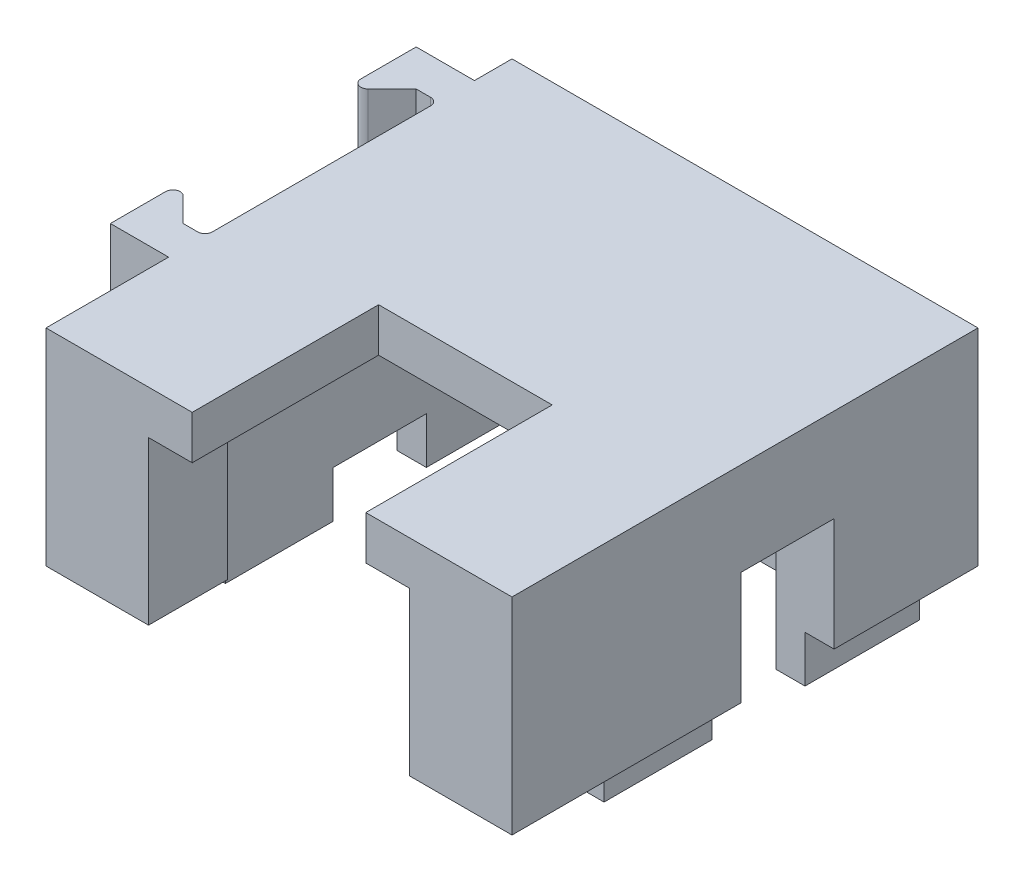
SolidWorks part; units mm, degrees
ref_plane "Front Plane" through (0, 0, 0) normal (0, 0, 1) x (1, 0, 0)
ref_plane "Top Plane" through (0, 0, 0) normal (0, 1, 0) x (1, 0, 0)
ref_plane "Right Plane" through (0, 0, 0) normal (1, 0, 0) x (0, 0, -1)
sketch "Sketch1" plane through (0, 0, 0) normal (0, 1, 0) x (1, 0, 0)
  line L1 (-12.7, 12.7) -> (12.7, 12.7)
  line L2 (-12.7, 12.7) -> (-12.7, -12.7)
  line L3 (-12.7, -12.7) -> (12.7, -12.7)
  line L4 (12.7, 12.7) -> (12.7, -12.7)
  line L5 (-12.7, 12.7) -> (12.7, -12.7) construction
  line L6 (-12.7, -12.7) -> (12.7, 12.7) construction
  point P0 (0, 0)
  dimension "D1" = 25.4
  dimension "D2" = 25.4
extrude "Boss-Extrude1" add sketch "Sketch1" along normal blind 11.2395
sketch "Sketch2" plane through (0, 0, 0) normal (0, -1, 0) x (-1, 0, 0)
  line L0 (12.7, -12.7) -> (-12.7, -12.7) construction
  line L1 (9.525, 9.525) -> (-9.525, 9.525)
  line L2 (9.525, 9.525) -> (9.525, -9.525)
  line L3 (9.525, -9.525) -> (-9.525, -9.525)
  line L4 (-9.525, 9.525) -> (-9.525, -9.525)
  line L5 (9.525, 9.525) -> (-9.525, -9.525) construction
  line L6 (9.525, -9.525) -> (-9.525, 9.525) construction
  line L7 (12.7, 12.7) -> (12.7, -12.7) construction
  point P0 (0, 0)
  dimension "D1" = 3.175
  dimension "D2" = 3.175
extrude "Cut-Extrude1" cut sketch "Sketch2" against normal offset from surface (8.8582 mm away) 2.3813
ref_plane "Plane1" through (0, 0, 0) normal (-1, 0, 0) x (0, 0, 1)
sketch "Sketch5" plane through (0, 11.2395, 0) normal (0, 1, 0) x (1, 0, 0)
  line L0 (-7.112, -12.7) -> (-7.112, -2.54)
  line L1 (-12.7, -12.7) -> (12.7, -12.7) construction
  line L2 (-7.112, -2.54) -> (7.112, -2.54)
  line L3 (7.112, -2.54) -> (7.112, -12.7)
  line L4 (7.112, -12.7) -> (-7.112, -12.7)
  line L6 (0, 12.7) -> (0, -12.7) construction
  line L7 (12.7, 12.7) -> (-12.7, 12.7) construction
  dimension "D1" = 10.16
  dimension "D2" = 14.224
extrude "Cut-Extrude3" cut sketch "Sketch5" against normal through all
sketch "Sketch16" plane through (0, 0, 0) normal (0, -1, 0) x (1, 0, 0)
  line L0 (-9.525, 9.525) -> (-12.7, 9.525) construction
  line L2 (-11.1125, 9.525) -> (-9.525, 9.525)
  line L3 (-9.525, -9.525) -> (-12.7, -9.525) construction
  line L5 (-12.7, -12.7) -> (-12.7, 12.7) construction
  line L6 (-11.1125, 9.525) -> (-11.1125, -9.525)
  line L7 (9.525, -9.525) -> (9.525, -12.7) construction
  line L8 (12.7, -12.7) -> (-12.7, -12.7) construction
  line L9 (9.525, -11.1125) -> (-11.1125, -11.1125)
  line L10 (-11.1125, -11.1125) -> (-11.1125, -9.525)
  line L11 (9.525, 9.525) -> (12.7, 9.525) construction
  line L12 (12.7, 12.7) -> (12.7, -12.7) construction
  line L13 (11.1125, 9.525) -> (11.1125, -11.1125)
  line L14 (9.525, -11.1125) -> (11.1125, -11.1125)
  line L15 (-11.1125, 6.096) -> (-9.525, 6.096)
  line L17 (11.1125, 9.525) -> (9.525, 9.525)
  line L18 (9.525, 6.096) -> (11.1125, 6.096)
  line L21 (9.525, 9.525) -> (9.525, -9.525)
  line L22 (9.525, -9.525) -> (-9.525, -9.525)
  line L23 (-9.525, -9.525) -> (-9.525, 9.525)
  dimension "D1" = 3.429
extrude "Boss-Extrude2" add sketch "Sketch16" along normal blind 2.54 contours L18 L15 L6 L10 L9 L14 L13 M10 M11 M12
sketch "Sketch14" plane through (12.7, -0.7937, 0) normal (-1, 0, 0) x (0, 1, 0)
  line L0 (12.0332, -12.7) -> (12.0332, 12.7) construction
  line L1 (4.572, -0.2223) -> (6.9532, -0.2223)
  line L2 (4.572, -0.2223) -> (4.572, 4.8578)
  line L3 (4.572, 4.8578) -> (6.9532, 4.8578)
  line L4 (6.9532, -0.2223) -> (6.9532, 4.8578)
  line L5 (12.0332, 4.8578) -> (0.7937, 4.8578) construction
  line L6 (12.0332, -12.7) -> (0.7937, -12.7) construction
  line L7 (12.0332, -0.2223) -> (0.7937, -0.2223) construction
  line L8 (0.7937, -12.7) -> (0.7937, 12.7) construction
  dimension "D1" = 5.08
  dimension "D2" = 2.3813
  dimension "D3" = 12.4777
  dimension "D4" = 5.08
sketch "Sketch15" plane through (0, -2.54, 0) normal (0, -1, 0) x (1, 0, 0)
  line L1 (12.7, -4.8578) -> (-0.6961, -4.8578)
  line L2 (12.7, -4.8578) -> (12.7, 0.2222)
  line L3 (12.7, 0.2222) -> (-0.6961, 0.2222)
  line L4 (-0.6961, -4.8578) -> (-0.6961, 0.2222)
  line L6 (12.7, 0.2222) -> (12.7, -4.8578) construction
  line L7 (12.7, 12.7) -> (12.7, -12.7) construction
  dimension "D1" = 13.3961
loft "Cut-Loft4" cut profiles "Sketch14", "Sketch15"
sketch "Sketch20" plane through (0, 0, 2.54) normal (0, 0, 1) x (1, 0, 0)
  line L0 (7.112, 8.8582) -> (-7.112, 8.8582) construction
  line L1 (-7.112, 11.2395) -> (-4.7307, 11.2395)
  line L2 (-7.112, 11.2395) -> (-7.112, 8.8582)
  line L3 (-7.112, 8.8582) -> (-4.7307, 8.8582)
  line L4 (-4.7307, 11.2395) -> (-4.7307, 8.8582)
  line L6 (7.112, 11.2395) -> (4.7308, 11.2395)
  line L7 (7.112, 11.2395) -> (7.112, 8.8582)
  line L8 (7.112, 8.8582) -> (4.7308, 8.8582)
  line L9 (4.7308, 11.2395) -> (4.7308, 8.8582)
  dimension "D1" = 2.3813
  dimension "D2" = 2.3813
extrude "Boss-Extrude3" add sketch "Sketch20" along normal up to surface (10.16 mm away)
sketch "Sketch21" plane through (0, 0, 9.525) normal (0, 0, -1) x (-1, 0, 0)
  line L1 (7.112, 8.8582) -> (9.525, 8.8582)
  line L2 (7.112, 8.8582) -> (7.112, 0)
  line L3 (7.112, 0) -> (9.525, 0)
  line L4 (9.525, 8.8582) -> (9.525, 0)
  line L5 (-9.525, 0) -> (-7.112, 0)
  line L6 (-9.525, 0) -> (-9.525, 8.8582)
  line L7 (-9.525, 8.8582) -> (-7.112, 8.8582)
  line L8 (-7.112, 0) -> (-7.112, 8.8582)
extrude "Boss-Extrude4" add sketch "Sketch21" along normal blind 1.143
sketch "Sketch22" plane through (-12.7, 0, 0) normal (-1, 0, 0) x (0, 0, 1)
  line L0 (-12.7, 0) -> (12.7, 0) construction
  line L1 (-4.8578, 0) -> (0.2222, 0)
  line L2 (-4.8578, 0) -> (-4.8578, -2.54)
  line L3 (-4.8578, -2.54) -> (0.2222, -2.54)
  line L4 (0.2222, 0) -> (0.2222, -2.54)
  line L5 (-4.8578, 4.0976) -> (-4.8578, -2.54) construction
  line L6 (0.2222, -2.54) -> (0.2222, 4.0976) construction
  line L7 (6.096, -2.54) -> (-11.1125, -2.54) construction
extrude "Cut-Extrude4" cut sketch "Sketch22" against normal up to surface (3.175 mm away)
sketch "Sketch23" plane through (0, 0, 0) normal (0, -1, 0) x (1, 0, 0)
  line L0 (-12.7, -10.6521) -> (-15.875, -10.6521)
  line L1 (-12.7, -12.7) -> (-12.7, 12.7) construction
  line L2 (-15.875, -10.6521) -> (-15.875, -6.6834)
  line L3 (-15.875, -6.6834) -> (-13.8906, -8.6677)
  line L4 (-13.8906, -8.6677) -> (-12.7, -8.6677)
  line L5 (-12.7, -8.6677) -> (-12.7, -10.6521)
  dimension "D1" = 45
  dimension "D2" = 1.1906
  dimension "D3" = 3.175
  dimension "D4" = 3.9688
  dimension "D5" = 3.81
extrude "Boss-Extrude5" add sketch "Sketch23" against normal up to surface (11.2395 mm away)
fillet "Fillet1" radius 0.3969 2 edges at (-15.875, 5.6197, -6.6834)
ref_plane "Plane2" through (0, 0, -2.3178) normal (0, 0, 1) x (1, 0, 0)
mirror "Mirror1" about plane through (0, 0, -2.3178) normal (0, 0, 1) of "Fillet1", "Boss-Extrude5"
sketch "Sketch24" plane through (0, 0, 0) normal (0, -1, 0) x (1, 0, 0)
  line L1 (-12.7, -10.6521) -> (-15.875, -10.6521)
  line L2 (-12.7, -10.6521) -> (-12.7, 6.0166)
  line L3 (-12.7, 6.0166) -> (-15.875, 6.0166)
  line L4 (-15.875, -10.6521) -> (-15.875, 6.0166)
extrude "Cut-Extrude5" cut sketch "Sketch24" against normal blind 0.254
sketch "Sketch25" plane through (0, 0, -10.6521) normal (0, 0, -1) x (-1, 0, 0)
  line L0 (14.2875, 11.2395) -> (14.2875, 0.254) construction
  line L1 (15.875, 11.2395) -> (12.7, 11.2395) construction
  line L2 (15.875, 0.254) -> (12.7, 0.254) construction
  point P6 (14.2875, 5.7468)
hole_wizard "#0-80 Tapped Hole1" positions "3DSketch1" profile "Sketch26" tap size "#0-80" standard "ANSI Inch"
sketch3d "3DSketch1"
  point P0 (-14.2875, 5.7468, -10.6521)
sketch "Sketch26" plane through (-14.2875, 5.7468, -10.6521) normal (1, 0, 0) x (0, 1, 0)
  line L0 (0, 0) -> (0, 6.1523)
  line L1 (0, 6.1523) -> (0.5956, 5.7944)
  line L2 (0.5956, 5.7944) -> (0.5956, 0)
  line L5 (0.5956, 0) -> (0, 0)
  line L10 (0, 6.1523) -> (-0.5956, 5.7944) construction
  line L11 (0, -6.35) -> (0, 107.95) construction
  dimension "Tap Drill Dia." = 1.1913
  dimension "Tap Drill Depth" = 5.7944
  dimension "Drill Angle" = 118
equation "\"D1@Sketch15\"=0.3425in/tan(33deg)"
